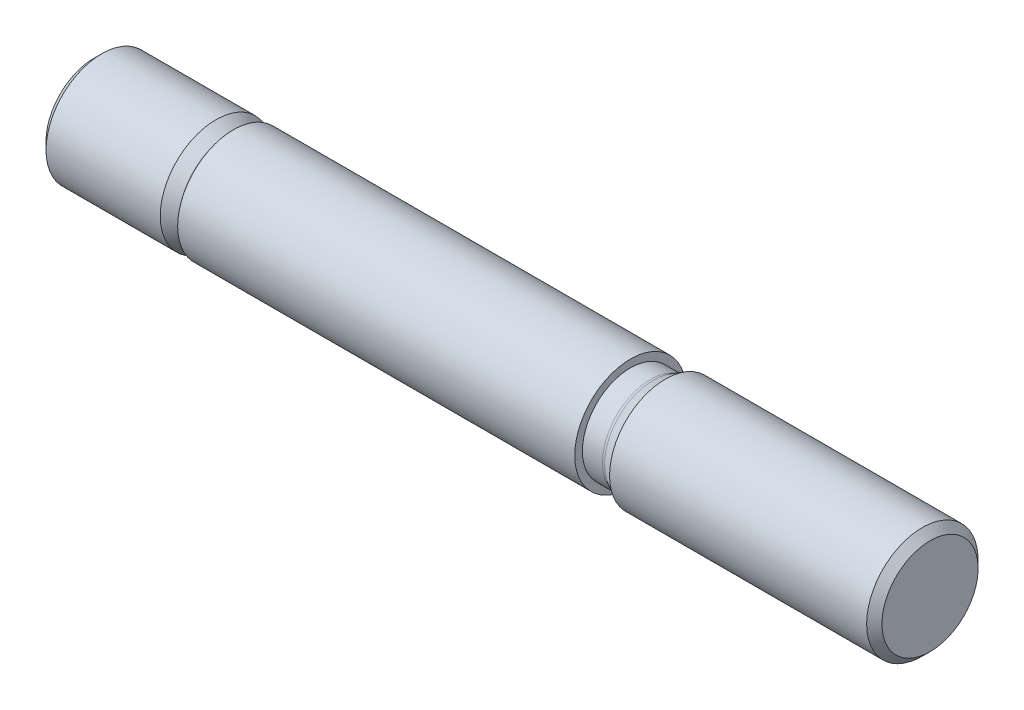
SolidWorks part; units mm, degrees
revolve "BaseBody" add sketch "BodySke" angle 360 about L14
sketch "BodySke" plane through (0, 0, 0) normal (0, 0, 1) x (1, 0, 0)
  line L0 (19.2196, 7.0072) -> (17.5, 8)
  line L1 (17.5, 8) -> (1.1, 8)
  line L2 (20, 8) -> (20, 6.9)
  line L3 (20, 6.9) -> (19.6196, 6.9)
  line L5 (1.1, 8) -> (0, 6.9)
  line L7 (77, 8) -> (77, 6.9)
  line L8 (77, 6.9) -> (79.8804, 6.9)
  line L9 (80.2804, 7.0072) -> (82, 8)
  line L10 (82, 8) -> (118.9, 8)
  line L11 (118.9, 8) -> (120, 6.9)
  line L12 (120, 6.9) -> (120, 0)
  line L13 (120, 0) -> (0, 0)
  line L14 (-3.175, 0) -> (101.6, 0) construction
  line L15 (99.7895, -6.9) -> (120, -6.9) construction
  line L16 (77, -6.9) -> (80.0947, -6.9) construction
  line L17 (11.034, -8) -> (77, -8) construction
  line L18 (0, 6.9) -> (0, 0)
  line L19 (20, 8) -> (77, 8)
  line L20 (82.0947, 11.7514) -> (82.0947, -5.6014) construction
  line L21 (82, 10.2761) -> (82, -5.5735) construction
  arc A0 (19.6196, 6.9) -> (19.2196, 7.0072) centre (19.6196, 7.7) cw
  arc A2 (79.8804, 6.9) -> (80.2804, 7.0072) centre (79.8804, 7.7) ccw
  point P26 (80.0947, 6.9)
  point P29 (77, 6.9)
ref_plane "Plane1" through (0, 0, 0) normal (0, 0, 1) x (1, 0, 0)
ref_plane "Plane2" through (0, 0, 0) normal (0, 1, 0) x (1, 0, 0)
ref_plane "Plane3" through (0, 0, 0) normal (1, 0, 0) x (0, 0, -1)
other "Configuration Table"
sketch "ThdSchSke" plane through (0, 0, 0) normal (0, 0, 1) x (1, 0, 0)
  line L0 (82, -6.9) -> (81.2298, -8)
  line L1 (82, -6.9) -> (82.7702, -8)
  line L2 (82.7702, -8) -> (82.7702, -10)
  line L3 (-3.175, 0) -> (5.1513, 0) construction
  line L4 (120, -6.9) -> (120, 6.9) construction
  line L5 (82.7702, -10) -> (81.2298, -10)
  line L6 (81.2298, -10) -> (81.2298, -8)
revolve "ThreadSchematic" [suppressed] cut sketch "ThdSchSke" angle 360 about L3
pattern_linear "ThdSchPat" [suppressed]
sketch "ThdSchSketStud" plane through (0, 0, 0) normal (0, 0, 1) x (1, 0, 0)
  line L0 (17.5, -6.9) -> (16.7298, -8)
  line L1 (17.5, -6.9) -> (18.2702, -8)
  line L2 (18.2702, -8) -> (18.2702, -10)
  line L3 (-3.175, 0) -> (5.1513, 0) construction
  line L5 (18.2702, -10) -> (16.7298, -10)
  line L6 (16.7298, -10) -> (16.7298, -8)
  line L7 (0, 6.9) -> (0, -6.9) construction
revolve "ThreadSchematicStud" [suppressed] cut sketch "ThdSchSketStud" angle 360 about L3
pattern_linear "ThdSchPatStud" [suppressed]
equation "\"Thread_minor@ThreadCosmetic\" = \"Minor_dia@BodySke\""
equation "\"Thrd_minor@ThreadCosmeticStud\" = \"Thread_minor@ThreadCosmetic\""
equation "\"Thread_len@BodySke\" = \"Thread_nom@BodySke\""
equation "\"Thread_minor@ThdSchSke\" = \"Minor_dia@BodySke\""
equation "\"Diameter@ThdSchSke\" = \"Thread_dia@BodySke\""
equation "\"Overcut@ThdSchSke\" = \"Thread_dia@BodySke\" * 1.25"
equation "\"Start@ThdSchSke\" = \"Thread_nom@BodySke\"  '   - \"Advance@BodySke\""
equation "\"Num_threads@ThdSchPat\" = int( \"Thread_len@BodySke\" / \"Advance@BodySke\" + 0.999 ) + 1"
equation "\"Advance@ThdSchPat\" = \"Thread_nom@BodySke\" /  ( \"Num_threads@ThdSchPat\" - 1 ) 'relax it"
equation "\"Diameter@ThdSchSketStud\" = \"Diameter@ThdSchSke\""
equation "\"Thread_minor@ThdSchSketStud\" = \"Thread_minor@ThdSchSke\""
equation "\"Overcut@ThdSchSketStud\" = \"Overcut@ThdSchSke\""
equation "\"Start_@ThdSchSketStud\"= \"Studend_length@BodySke\" - \"Shoulder_neck_width@BodySke\""
equation "\"Num_threads@ThdSchPatStud\" = int( \"Start_@ThdSchSketStud\"/ \"Advance@BodySke\" + 0.999 )  + 1"
equation "\"Advance@ThdSchPatStud\" = \"Start_@ThdSchSketStud\" /  ( \"Num_threads@ThdSchPatStud\" - 1 ) 'relax it"
